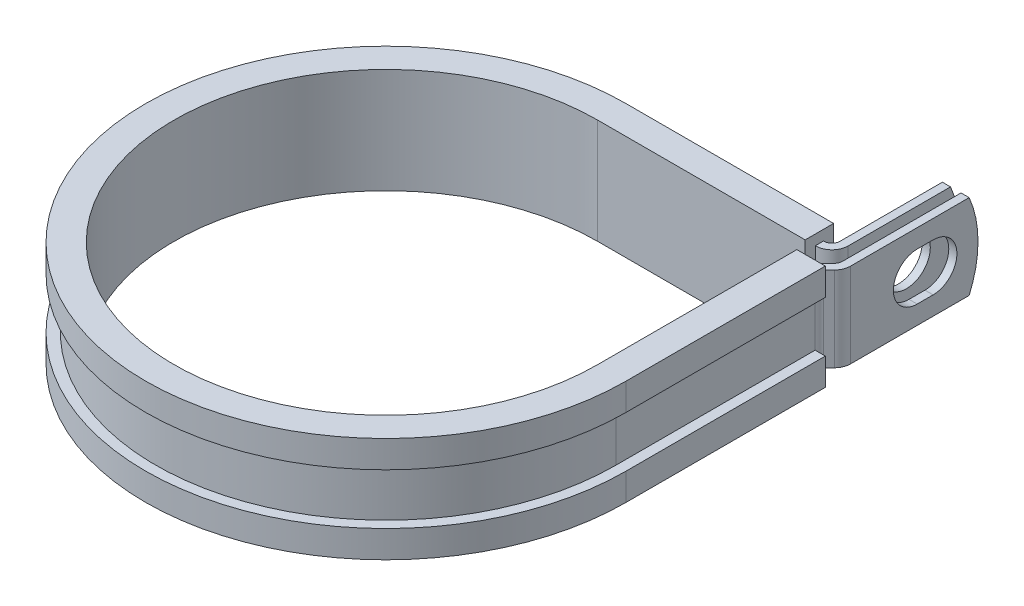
SolidWorks part; units mm, degrees
ref_plane "Front Plane" through (0, 0, 0) normal (0, 0, 1) x (1, 0, 0)
ref_plane "Top Plane" through (0, 0, 0) normal (0, 1, 0) x (1, 0, 0)
ref_plane "Right Plane" through (0, 0, 0) normal (1, 0, 0) x (0, 0, -1)
sketch "Sketch1" plane through (0, 0, 0) normal (0, 1, 0) x (1, 0, 0)
  line L0 (0, 33.274) -> (31.1583, 33.274)
  line L1 (33.274, 0) -> (33.274, 29.8615)
  line L2 (33.5967, 52.3748) -> (33.5967, 35.7124)
  line L3 (33.9882, 31.5857) -> (34.8144, 32.4119)
  line L5 (35.1715, 33.274) -> (35.1715, 52.3748)
  arc A0 (0, 33.274) -> (33.274, 0) centre (0, 0) ccw
  arc A1 (33.9882, 31.5857) -> (33.274, 29.8615) centre (35.7124, 29.8615) ccw
  arc A2 (34.8144, 32.4119) -> (35.1715, 33.274) centre (33.9523, 33.274) ccw
  arc A3 (31.1583, 33.274) -> (33.5967, 35.7124) centre (31.1583, 35.7124) ccw
extrude "Extrude-Thin1" add sketch "Sketch1" along normal mid plane 12.7 thin
sketch "Sketch2" plane through (32.3775, 0, 0) normal (-1, 0, 0) x (0, 0, 1)
  line L0 (-52.3748, 6.35) -> (-52.3748, -6.35) construction
  line L1 (0, 6.35) -> (0, -6.35) construction
  circle A0 centre (-44.45, 0) radius 3.5687
  point P2 (-52.3748, 0)
extrude "Cut-Extrude1" cut sketch "Sketch2" against normal up to surface (1.2192 mm away)
sketch "Sketch3" plane through (36.3907, 0, 0) normal (1, 0, 0) x (0, 0, -1)
  line L0 (43.2562, 0) -> (45.6438, 0) construction
  line L1 (43.2562, 3.5687) -> (45.6438, 3.5687)
  line L2 (43.2562, -3.5687) -> (45.6438, -3.5687)
  line L3 (52.3748, 6.35) -> (52.3748, -6.35) construction
  arc A0 (43.2562, 3.5687) -> (43.2562, -3.5687) centre (43.2562, 0) ccw
  arc A1 (45.6438, -3.5687) -> (45.6438, 3.5687) centre (45.6438, 0) ccw
  point P3 (44.45, 0)
  point P8 (52.3748, 0)
  point P11 (39.6875, 0)
  point P12 (49.2125, 0)
extrude "Cut-Extrude2" cut sketch "Sketch3" against normal up to surface (1.2192 mm away)
sketch "Sketch4" plane through (32.3775, 0, 0) normal (-1, 0, 0) x (0, 0, 1)
  line L0 (-52.3748, 6.35) -> (-52.3748, -6.35)
  line L1 (-52.3748, 6.35) -> (-51.0495, 6.35)
  line L2 (-52.3748, 6.35) -> (-35.7124, 6.35) construction
  line L3 (-52.3748, -6.35) -> (-51.0495, -6.35)
  line L4 (-52.3748, -6.35) -> (-35.7124, -6.35) construction
  arc A0 (-51.0495, 6.35) -> (-51.0495, -6.35) centre (-36.4998, 0) ccw
extrude "Cut-Extrude3" cut sketch "Sketch4" against normal through all contours A0 M4 M5 | A0 L0 M2
ref_plane "Plane1" through (0, 0, -29.8615) normal (0, 0, -1) x (-1, 0, 0)
ref_plane "Plane2" through (31.1075, 0, 0) normal (-1, 0, 0) x (0, 0, 1)
sketch "Sketch5" plane through (0, 0, -29.8615) normal (0, 0, -1) x (-1, 0, 0)
  line L0 (-34.4932, 6.35) -> (-33.274, 6.35)
  line L1 (-34.4932, 6.35) -> (-34.4932, -6.35) construction
  line L3 (-33.274, 6.35) -> (-33.274, -6.35)
  line L4 (-33.274, -6.35) -> (-34.4932, -6.35)
  line L5 (-34.4932, -6.35) -> (-34.4932, -3.81)
  line L6 (-34.4932, 6.35) -> (-34.4932, 3.81)
  line L7 (-36.0172, 7.874) -> (-36.0172, 3.81)
  line L8 (-36.0172, 7.874) -> (-31.75, 7.874)
  line L9 (-31.75, 7.874) -> (-31.75, -7.874)
  line L10 (-31.75, -7.874) -> (-36.0172, -7.874)
  line L11 (-36.0172, -7.874) -> (-36.0172, -3.81)
  line L12 (-36.0172, 3.81) -> (-34.4932, 3.81)
  line L13 (-34.4932, -3.81) -> (-36.0172, -3.81)
sketch "Sketch6" plane through (0, 6.35, 0) normal (0, 1, 0) x (1, 0, 0)
  line L0 (31.75, 0) -> (31.75, 29.8615)
  line L1 (31.75, 29.8615) -> (36.0172, 29.8615) construction
  line L2 (31.1075, 6.9878) -> (31.1075, -6.9878) construction
  line L5 (0, 31.75) -> (31.1075, 31.75)
  arc A0 (0, 31.75) -> (31.75, 0) centre (0, 0) ccw
sweep "Sweep1" add profiles "Sketch5" path "Sketch6"
equation "\"D4@Sketch5\" = \"D1@Extrude-Thin1\""
equation "\"D5@Sketch5\" = \"D5@Extrude-Thin1\""
equation "\"D1@Sketch3\" = \"D2@Sketch2\""
equation "\"D7@Sketch1\" = \"D3@Sketch2\" + \"D1@Sketch3\""
equation "\"D1@Sketch1\" = \"D1@Sketch6\" + 2 * \"D3@Sketch5\""
equation "\"D1@Sketch4\" = ( \"D1@Extrude-Thin1\" + .125 ) * 2"
equation "\"D9@Sketch1\"= \"D5@Extrude-Thin1\""
equation "\"D8@Sketch1\"= 2 * \"D5@Extrude-Thin1\""
equation "\"D2@Sketch1\" = 2 * \"D5@Extrude-Thin1\""
equation "\"D2@Sketch3\" = \"D1@Sketch2\""
